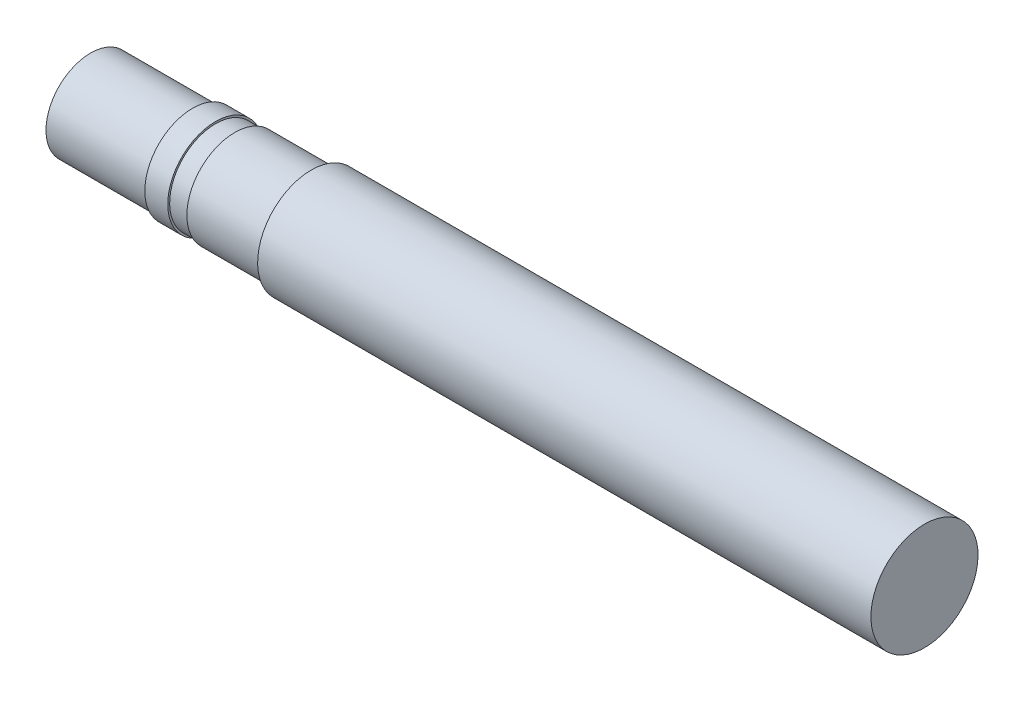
SolidWorks part; units mm, degrees
ref_plane "Front Plane" through (0, 0, 0) normal (0, 0, 1) x (1, 0, 0)
ref_plane "Top Plane" through (0, 0, 0) normal (0, 1, 0) x (1, 0, 0)
ref_plane "Right Plane" through (0, 0, 0) normal (1, 0, 0) x (0, 0, -1)
sketch "Sketch1" plane through (0, 0, 0) normal (0, 0, 1) x (1, 0, 0)
  line L0 (-574, 37.5) -> (-556, 37.5)
  line L1 (-481, 37.5) -> (-481, 42)
  line L2 (-481, 42) -> (0, 42)
  line L3 (0, 42) -> (0, 0)
  line L4 (0, 0) -> (-654, 0)
  line L5 (-654, 0) -> (-654, 35)
  line L6 (-574, 37.5) -> (-574, 35)
  line L7 (-574, 35) -> (-654, 35)
  line L8 (-556, 37.5) -> (-556, 36)
  line L9 (-556, 36) -> (-541, 36)
  line L10 (-541, 36) -> (-541, 37.5)
  line L11 (-541, 37.5) -> (-481, 37.5)
  dimension "D1" = 93
  dimension "D2" = 481
  dimension "D3" = 42
  dimension "D4" = 37.5
  dimension "D5" = 35
  dimension "D6" = 80
  dimension "D7" = 18
  dimension "D8" = 15
  dimension "D9" = 36
revolve "Revolve1" add sketch "Sketch1" angle 360 about L4
